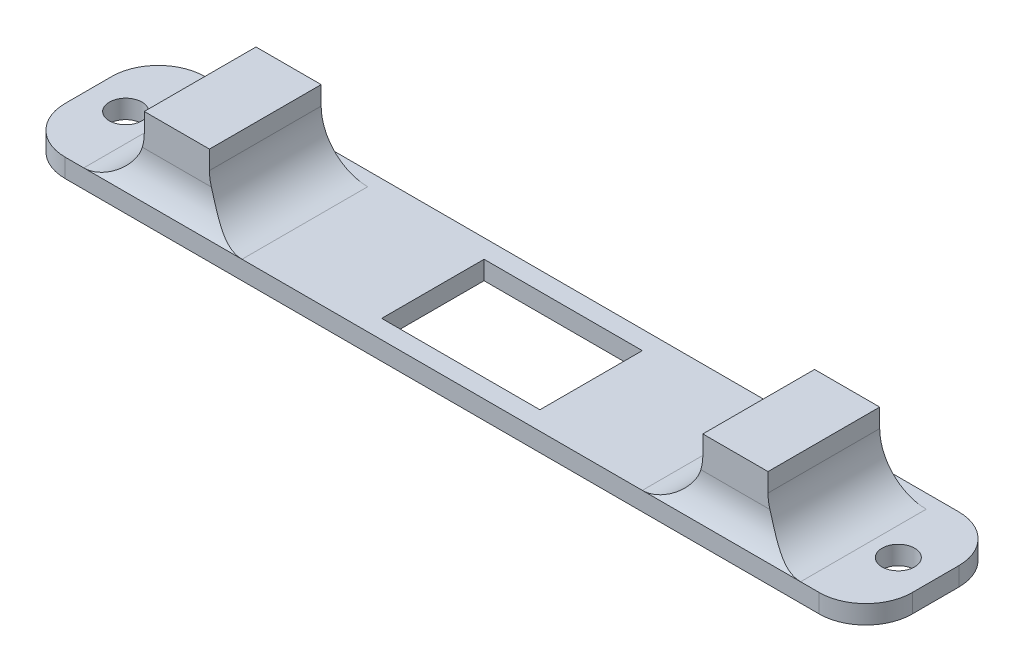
SolidWorks part; units mm, degrees
ref_plane "Front Plane" through (0, 0, 0) normal (0, 0, 1) x (1, 0, 0)
ref_plane "Top Plane" through (0, 0, 0) normal (0, 1, 0) x (1, 0, 0)
ref_plane "Right Plane" through (0, 0, 0) normal (1, 0, 0) x (0, 0, -1)
sketch "Sketch1" plane through (0, 0, 0) normal (0, 1, 0) x (1, 0, 0)
  line L1 (-33.5, 6) -> (-26.5, 6)
  line L2 (-33.5, 6) -> (-33.5, -6)
  line L3 (-33.5, -6) -> (-26.5, -6)
  line L4 (-26.5, 6) -> (-26.5, -6)
  line L5 (-33.5, 6) -> (-26.5, -6) construction
  line L6 (-33.5, -6) -> (-26.5, 6) construction
  line L7 (26.5, 6) -> (33.5, 6)
  line L8 (26.5, 6) -> (26.5, -6)
  line L9 (26.5, -6) -> (33.5, -6)
  line L10 (33.5, 6) -> (33.5, -6)
  line L11 (26.5, 6) -> (33.5, -6) construction
  line L12 (26.5, -6) -> (33.5, 6) construction
  point P0 (-30, 0)
  point P5 (30, 0)
  point P11 (0, 0)
  dimension "D1" = 60
  dimension "D2" = 30
  dimension "D3" = 7
  dimension "D4" = 12
  dimension "D5" = 7
  dimension "D6" = 12
extrude "Boss-Extrude1" add sketch "Sketch1" along normal blind 7
sketch "Sketch2" plane through (0, 0, -6) normal (0, 0, -1) x (-1, 0, 0)
  line L8 (27.25, 0.75) -> (32.75, 0.75)
  line L9 (32.75, 0.75) -> (32.75, 6.25)
  line L10 (32.75, 6.25) -> (27.25, 6.25)
  line L11 (27.25, 6.25) -> (27.25, 0.75)
  line L12 (27.25, 0.75) -> (32.75, 0.75)
  line L13 (32.75, 0.75) -> (32.75, 6.25)
  line L14 (32.75, 6.25) -> (27.25, 6.25)
  line L15 (27.25, 6.25) -> (27.25, 0.75)
  line L20 (-32.75, 0.75) -> (-27.25, 0.75)
  line L21 (-27.25, 0.75) -> (-27.25, 6.25)
  line L22 (-27.25, 6.25) -> (-32.75, 6.25)
  line L23 (-32.75, 6.25) -> (-32.75, 0.75)
  line L24 (-32.75, 0.75) -> (-27.25, 0.75)
  line L25 (-27.25, 0.75) -> (-27.25, 6.25)
  line L26 (-27.25, 6.25) -> (-32.75, 6.25)
  line L27 (-32.75, 6.25) -> (-32.75, 0.75)
  dimension "D2" = 0.75
  dimension "D1" = 0.75
extrude "Cut-Extrude1" cut sketch "Sketch2" against normal blind 10.5
sketch "Sketch3" plane through (0, 0, 0) normal (0, -1, 0) x (1, 0, 0)
  line L1 (-45.5, 7.5) -> (45.5, 7.5)
  line L2 (-45.5, 7.5) -> (-45.5, -7.5)
  line L3 (-45.5, -7.5) -> (45.5, -7.5)
  line L4 (45.5, 7.5) -> (45.5, -7.5)
  line L5 (-45.5, 7.5) -> (45.5, -7.5) construction
  line L6 (-45.5, -7.5) -> (45.5, 7.5) construction
  line L11 (-8.5, 5.5) -> (8.5, 5.5)
  line L12 (-8.5, 5.5) -> (-8.5, -5.5)
  line L13 (-8.5, -5.5) -> (8.5, -5.5)
  line L14 (8.5, 5.5) -> (8.5, -5.5)
  line L15 (-8.5, 5.5) -> (8.5, -5.5) construction
  line L16 (-8.5, -5.5) -> (8.5, 5.5) construction
  point P0 (0, 0)
  point P6 (0, 0)
  point P7 (0, 0)
  dimension "D1" = 17
  dimension "D2" = 15
  dimension "D3" = 91
  dimension "D4" = 11
extrude "Boss-Extrude3" add sketch "Sketch3" along normal blind 2
fillet "Fillet1" radius 5 6 edges at (33.5, 0, 0) (30, 0, 6) (26.5, 0, 0) (-30, 0, 6) (-26.5, 0, 0) (-33.5, 0, 0)
sketch "Sketch4" plane through (0, 0, 0) normal (0, 1, 0) x (1, 0, 0)
  line L2 (-8.5, -5.5) -> (-8.5, 5.5) construction
  line L3 (8.5, 5.5) -> (8.5, -5.5) construction
  circle A0 centre (-41.5, 0) radius 1.75
  circle A1 centre (41.5, 0) radius 1.75
  point P4 (0, 0)
  point P10 (0, 0)
  dimension "D1" = 3.5
  dimension "D2" = 3.5
  dimension "D3" = 33
  dimension "D4" = 33
extrude "Cut-Extrude3" cut sketch "Sketch4" against normal through all both
fillet "Fillet2" radius 5 4 edges at (45.5, -1, -7.5) (45.5, -1, 7.5) (-45.5, -1, 7.5) (-45.5, -1, -7.5)
